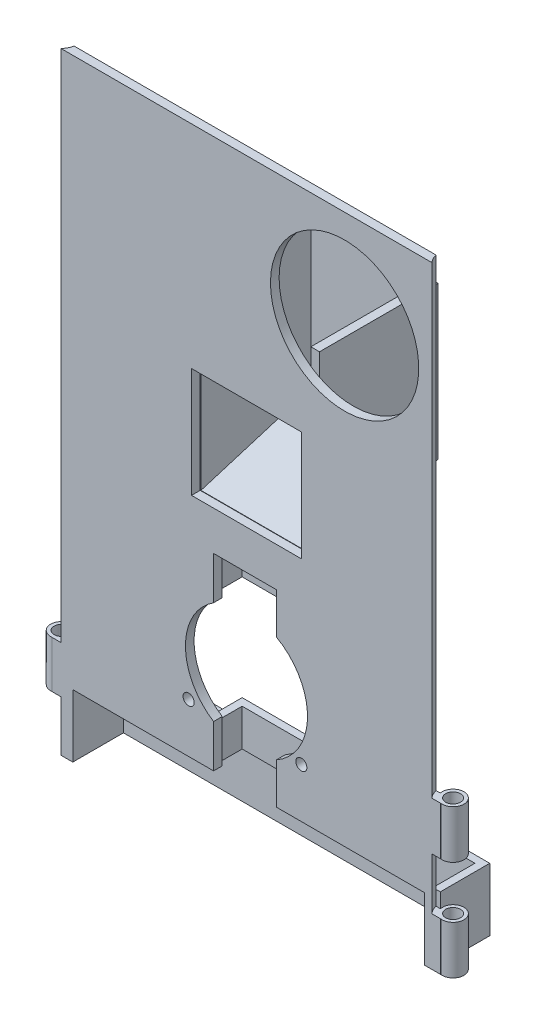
SolidWorks part; units mm, degrees
ref_plane "Front Plane" through (0, 0, 0) normal (0, 0, 1) x (1, 0, 0)
ref_plane "Top Plane" through (0, 0, 0) normal (0, 1, 0) x (1, 0, 0)
ref_plane "Right Plane" through (0, 0, 0) normal (1, 0, 0) x (0, 0, -1)
sketch "Sketch1" plane through (0, 0, 0) normal (0, 0, 1) x (1, 0, 0)
  line L1 (0, 0) -> (62.865, 0)
  line L2 (0, 0) -> (0, 99.06)
  line L3 (0, 99.06) -> (62.865, 99.06)
  line L4 (62.865, 0) -> (62.865, 99.06)
  dimension "D1" = 99.06
  dimension "D2" = 62.865
extrude "Boss-Extrude1" add sketch "Sketch1" along normal blind 1.4
sketch "Sketch2" plane through (0, 0, 0) normal (0, 1, 0) x (1, 0, 0)
  line L0 (31.4325, -1.4) -> (31.4325, 2.6427) construction
  line L1 (62.865, -1.4) -> (0, -1.4) construction
  line L2 (0, -1.4) -> (0, 0) construction
  circle A0 centre (-0.25, 0.35) radius 1.75
  circle A1 centre (63.115, 0.35) radius 1.75
  point P8 (0, -0.7)
  dimension "D1" = 0.25
extrude "Boss-Extrude2" add sketch "Sketch2" along normal up to surface (99.06 mm away)
ref_plane "Plane1" through (0, 12, 0) normal (0, 1, 0) x (1, 0, 0)
sketch "Sketch7" plane through (0, 12, 0) normal (0, 1, 0) x (1, 0, 0)
  line L0 (31.4325, -1.4) -> (31.4325, 1.55) construction
  line L1 (62.865, -1.4) -> (0, -1.4) construction
  circle A1 centre (-0.25, 0.35) radius 1.2
  circle A2 centre (63.115, 0.35) radius 1.2
extrude "Tube Hole" cut sketch "Sketch7" against normal through all both and the other way through all
sketch "Sketch8" plane through (0, 0, 0) normal (0, 0, -1) x (-1, 0, 0)
  line L0 (-31.4325, 99.06) -> (-31.4325, 40.64) construction
  line L1 (-61.4004, 99.06) -> (-1.4646, 99.06) construction
  line L2 (-1.4646, 0) -> (-61.4004, 0) construction
  line L3 (-36.2672, 16.7864) -> (-36.2672, 10.16)
  line L4 (-40.3225, 64.77) -> (-22.5425, 64.77)
  line L5 (-40.3225, 64.77) -> (-40.3225, 46.99)
  line L6 (-40.3225, 46.99) -> (-22.5425, 46.99)
  line L7 (-22.5425, 64.77) -> (-22.5425, 46.99)
  line L8 (-40.3225, 64.77) -> (-22.5425, 46.99) construction
  line L9 (-40.3225, 46.99) -> (-22.5425, 64.77) construction
  line L10 (-36.2672, 40.64) -> (-26.1072, 40.64)
  line L11 (-36.2672, 40.64) -> (-36.2672, 34.0136)
  line L12 (-36.2672, 10.16) -> (-26.1072, 10.16)
  line L13 (-26.1072, 40.64) -> (-26.1072, 33.7192)
  line L14 (-26.1072, 17.0808) -> (-26.1072, 10.16)
  line L17 (-31.4325, 10.16) -> (-31.4325, 0) construction
  circle A0 centre (-47.3125, 83.18) radius 12
  arc A1 (-36.2672, 34.0136) -> (-36.2672, 16.7864) centre (-31.4325, 25.4) ccw
  arc A3 (-26.1072, 17.0808) -> (-26.1072, 33.7192) centre (-31.4325, 25.4) ccw
  point P8 (-31.4325, 55.88)
  point P15 (-31.4325, 25.4)
  dimension "D6" = 25.4
  dimension "D7" = 10.16
  dimension "D1" = 15.88
  dimension "D2" = 15.88
  dimension "D3" = 17.78
  dimension "D4" = 17.78
  dimension "D5" = 46.99
  dimension "D8" = 30.48
  dimension "D9" = 10.16
extrude "Panel Holes" cut sketch "Sketch8" against normal blind 4.2
sketch "Sketch9" plane through (0, 12, 0) normal (0, 1, 0) x (1, 0, 0)
  circle A0 centre (63.115, 0.35) radius 2.4
extrude "Cut-Extrude1" cut sketch "Sketch9" against normal blind 4.2 and the other way blind 4.2
sketch "Sketch10" plane through (0, 12, 0) normal (0, 1, 0) x (1, 0, 0)
  circle A0 centre (63.115, 0.35) radius 2.4
extrude "Cut-Extrude2" cut sketch "Sketch10" along normal up to surface (75.06 mm away) from offset 12
sketch "Sketch11" plane through (0, 12, 0) normal (0, 1, 0) x (1, 0, 0)
  circle A0 centre (-0.25, 0.35) radius 2.4
extrude "Cut-Extrude3" cut sketch "Sketch11" against normal up to surface (8.2 mm away) from offset 3.8
sketch "Sketch12" plane through (0, 12, 0) normal (0, 1, 0) x (1, 0, 0)
  circle A0 centre (-0.25, 0.35) radius 2.4
extrude "Cut-Extrude4" cut sketch "Sketch12" along normal up to surface (83.26 mm away) from offset 3.8
sketch "Sketch13" plane through (0, 0, 0) normal (0, 0, -1) x (-1, 0, 0)
  line L0 (-31.4325, 99.06) -> (-31.7623, 0) construction
  line L1 (-60.7407, 99.06) -> (-2.1243, 99.06) construction
  line L2 (-2.1243, 0) -> (-61.4004, 0) construction
  line L3 (-40.3225, 46.99) -> (-22.5425, 46.99) construction
  line L4 (-41.8498, 76.07) -> (-21.2698, 76.07)
  line L5 (-41.8498, 76.07) -> (-41.8498, 45.59)
  line L6 (-41.8498, 45.59) -> (-21.2698, 45.59)
  line L7 (-21.2698, 76.07) -> (-21.2698, 45.59)
  line L8 (-41.8498, 76.07) -> (-21.2698, 45.59) construction
  line L9 (-41.8498, 45.59) -> (-21.2698, 76.07) construction
  point P6 (-31.5598, 60.83)
  dimension "D1" = 1.4
  dimension "D2" = 20.58
  dimension "D3" = 30.48
extrude "Boss-Extrude3" add sketch "Sketch13" along normal blind 19.18
sketch "Sketch14" plane through (0, 76.07, 0) normal (0, 1, 0) x (1, 0, 0)
  line L0 (60.7407, 0) -> (2.1243, 0) construction
  line L1 (22.6698, 0) -> (40.4498, 0)
  line L2 (22.6698, 0) -> (22.6698, 17.78)
  line L3 (22.6698, 17.78) -> (40.4498, 17.78)
  line L4 (40.4498, 0) -> (40.4498, 17.78)
  line L5 (21.2698, 19.18) -> (21.2698, 0) construction
  line L6 (41.8498, 19.18) -> (41.8498, 0) construction
  line L7 (21.2698, 19.18) -> (41.8498, 19.18) construction
  dimension "D1" = 1.4
  dimension "D2" = 1.4
  dimension "D3" = 1.4
sketch "Sketch15" plane through (21.2698, 0, 0) normal (-1, 0, 0) x (0, 0, 1)
  line L0 (-19.18, 45.59) -> (-19.18, 76.07) construction
  line L1 (-19.18, 51.432) -> (0, 45.59)
  line L2 (0, 45.59) -> (-19.18, 45.59)
  line L3 (-19.18, 45.59) -> (-19.18, 51.432)
  point P0 (-19.18, 51.432)
  dimension "D1" = 5.842
extrude "Cut-Extrude5" cut sketch "Sketch15" against normal through all
extrude "Cut-Extrude6" cut sketch "Sketch14" against normal offset from surface (29.0165 mm away) 1.4
sketch "Sketch16" plane through (0, 0, 0) normal (0, 0, -1) x (-1, 0, 0)
  line L0 (-41.3102, 25.4) -> (-21.5548, 25.4) construction
  line L1 (-31.1872, 40.64) -> (-31.1872, 10.16) construction
  line L2 (-26.1072, 40.64) -> (-36.2672, 40.64) construction
  line L3 (-36.2672, 10.16) -> (-26.1072, 10.16) construction
  line L4 (-38.0435, 16.3394) -> (-24.331, 10.3394) construction
  line L5 (-38.0435, 40.4606) -> (-24.331, 40.4606)
  line L6 (-38.0435, 40.4606) -> (-38.0435, 34.4606)
  line L7 (-38.0435, 34.4606) -> (-24.331, 34.4606)
  line L8 (-24.331, 40.4606) -> (-24.331, 34.4606)
  line L9 (-38.0435, 40.4606) -> (-24.331, 34.4606) construction
  line L10 (-38.0435, 34.4606) -> (-24.331, 40.4606) construction
  line L11 (-38.0435, 10.3394) -> (-24.331, 16.3394) construction
  line L12 (-24.331, 10.3394) -> (-24.331, 16.3394)
  line L13 (-38.0435, 16.3394) -> (-24.331, 16.3394)
  line L14 (-38.0435, 10.3394) -> (-38.0435, 16.3394)
  line L15 (-38.0435, 10.3394) -> (-24.331, 10.3394)
  arc A0 (-36.2672, 34.0136) -> (-36.2672, 16.7864) centre (-31.4325, 25.4) ccw construction
  arc A1 (-26.1072, 17.0808) -> (-26.1072, 33.7192) centre (-31.4325, 25.4) ccw construction
  point P14 (-31.1872, 37.4606)
  point P23 (-31.1872, 13.3394)
  dimension "D1" = 6
extrude "Boss-Extrude4" add sketch "Sketch16" along normal blind 5
sketch "Sketch17" plane through (0, 40.4606, 0) normal (0, 1, 0) x (1, 0, 0)
  line L0 (40.3225, 0) -> (22.6698, 0) construction
  line L1 (25.531, 0) -> (36.8435, 0)
  line L2 (25.531, 0) -> (25.531, 3.8)
  line L3 (25.531, 3.8) -> (36.8435, 3.8)
  line L4 (36.8435, 0) -> (36.8435, 3.8)
  line L5 (38.0435, 5) -> (38.0435, 0) construction
  line L6 (24.331, 5) -> (24.331, 0) construction
  line L7 (24.331, 5) -> (38.0435, 5) construction
  dimension "D1" = 1.2
  dimension "D2" = 1.2
  dimension "D3" = 1.2
extrude "Cut-Extrude7" cut sketch "Sketch17" against normal through all
sketch "Sketch18" plane through (0, 0, 0) normal (0, 0, -1) x (-1, 0, 0)
  line L0 (-31.7623, 0) -> (-31.7623, 25.1767) construction
  line L1 (-2.1243, 0) -> (-61.4004, 0) construction
  line L3 (-61.4004, 10.16) -> (-2.1243, 10.16)
  line L4 (-61.4004, 10.16) -> (-61.4004, 0)
  line L5 (-61.4004, 0) -> (-2.1243, 0)
  line L6 (-2.1243, 10.16) -> (-2.1243, 0)
  line L7 (-61.4004, 10.16) -> (-2.1243, 0) construction
  line L8 (-61.4004, 0) -> (-2.1243, 10.16) construction
  point P4 (-31.7623, 5.08)
  dimension "D1" = 10.16
extrude "Boss-Extrude5" add sketch "Sketch18" along normal blind 8
sketch "Sketch19" plane through (0, 0, 0) normal (0, -1, 0) x (1, 0, 0)
  line L0 (31.7623, -8) -> (31.7623, 1.4) construction
  line L1 (61.4004, -8) -> (2.1243, -8) construction
  line L2 (1.3924, 1.4) -> (62.865, 1.4) construction
  line L3 (2.1243, -8) -> (2.1243, 0) construction
  line L4 (3.3243, 3.1736) -> (60.2004, 3.1736)
  line L5 (3.3243, 3.1736) -> (3.3243, -6.8)
  line L6 (3.3243, -6.8) -> (60.2004, -6.8)
  line L7 (60.2004, 3.1736) -> (60.2004, -6.8)
  line L8 (3.3243, 3.1736) -> (60.2004, -6.8) construction
  line L9 (3.3243, -6.8) -> (60.2004, 3.1736) construction
  line L10 (61.4004, -8) -> (61.4004, -0.7) construction
  point P6 (31.7623, -1.8132)
  point P13 (2.1243, -4)
  dimension "D1" = 1.2
  dimension "D2" = 1.2
  dimension "D3" = 1.2
extrude "Cut-Extrude8" cut sketch "Sketch19" against normal up to surface (10.16 mm away)
sketch "Sketch20" plane through (0, 0, 1.4) normal (0, 0, 1) x (1, 0, 0)
  line L0 (11.8679, 18.16) -> (49.8625, 18.16) construction
  line L1 (60.2004, 10.16) -> (36.2672, 10.16) construction
  line L2 (31.1872, 40.4606) -> (31.1872, 10.3394) construction
  line L3 (36.8435, 40.4606) -> (25.531, 40.4606) construction
  line L4 (36.8435, 10.3394) -> (25.531, 10.3394) construction
  circle A0 centre (40.3061, 18.16) radius 0.9
  circle A1 centre (22.0684, 18.16) radius 0.9
  dimension "D1" = 8
extrude "Cut-Extrude9" cut sketch "Sketch20" against normal blind 8
